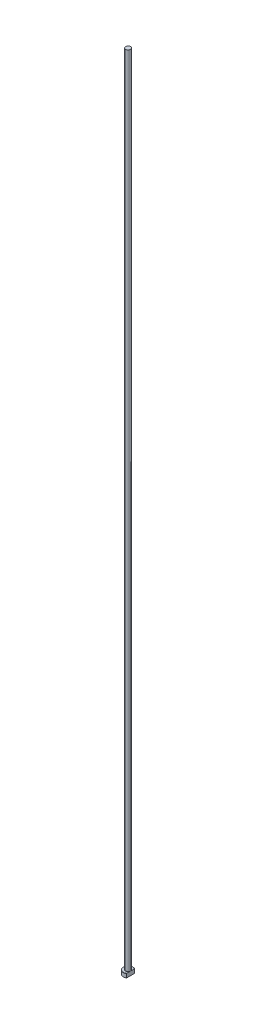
SolidWorks part; units mm, degrees
ref_plane "Front Plane" through (0, 0, 0) normal (0, 0, 1) x (1, 0, 0)
ref_plane "Top Plane" through (0, 0, 0) normal (0, 1, 0) x (1, 0, 0)
ref_plane "Right Plane" through (0, 0, 0) normal (1, 0, 0) x (0, 0, -1)
sketch "Sketch1" plane through (0, 0, 0) normal (0, 0, 1) x (1, 0, 0)
  line L0 (0, 259.9588) -> (0, -15.1925) construction
  line L1 (0, 0) -> (-6, 0)
  line L2 (-6, 0) -> (-6, 5)
  line L3 (-6, 5) -> (-3, 5)
  line L4 (-3, 5) -> (-3, 1000)
  line L5 (-3, 1000) -> (0, 1000)
  line L6 (0, 1000) -> (0, 0)
  dimension "L" = 1000
  dimension "H" = 12
  dimension "T" = 5
  dimension "D" = 6
revolve "Revolve1" add sketch "Sketch1" angle 360 about L0
chamfer "Chamfer1" distance 0.2 angle 45 2 edges at (0, 5, 6) (0, 0, 6)
fillet "Fillet1" radius 0.2 1 edges at (0, 5, 3)
sketch "Sketch2" plane through (0, 0, 0) normal (0, 1, 0) x (1, 0, 0)
  line L0 (3, 5.1962) -> (3, -5.1962)
  circle A0 centre (0, 0) radius 6 construction
  arc A1 (3, -5.1962) -> (3, 5.1962) centre (0, 0) ccw
  circle A2 centre (0, 0) radius 3 construction
extrude "KEY" cut sketch "Sketch2" along normal through all
